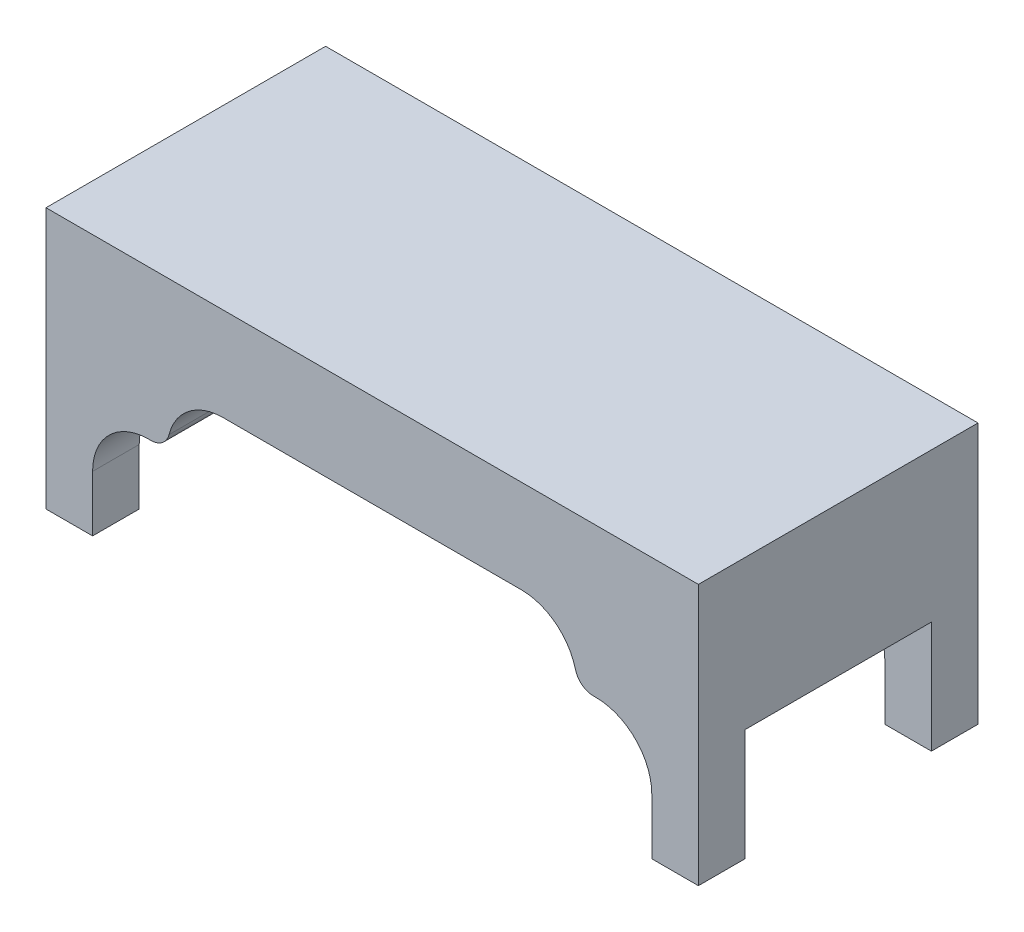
SolidWorks part; units mm, degrees
ref_plane "Vorne" through (0, 0, 0) normal (0, 0, 1) x (1, 0, 0)
ref_plane "Oben" through (0, 0, 0) normal (0, 1, 0) x (1, 0, 0)
ref_plane "Rechts" through (0, 0, 0) normal (1, 0, 0) x (0, 0, -1)
sketch "Skizze1" plane through (0, 0, 0) normal (0, 0, 1) x (1, 0, 0)
  line L0 (-8, 0) -> (8, 0) construction
  line L1 (-11.873, -3) -> (-25, -3) construction
  line L2 (-25, -3) -> (-25, -8) construction
  line L3 (-25, -8) -> (25, -8) construction
  line L4 (25, -8) -> (25, -3) construction
  line L5 (25, -3) -> (11.873, -3) construction
  line L6 (0, 0) -> (0, 3.5785) construction
  line L7 (-8, 2) -> (8, 2)
  line L8 (-11.873, -1) -> (-17.5, -1)
  line L9 (-17.5, -1) -> (-17.5, 7)
  line L10 (-17.5, 7) -> (17.5, 7)
  line L11 (17.5, 7) -> (17.5, -1)
  line L12 (17.5, -1) -> (11.873, -1)
  arc A0 (8.9682, -0.75) -> (11.873, -3) centre (11.873, 0) ccw construction
  arc A1 (8.9682, -0.75) -> (8, 0) centre (8, -1) ccw construction
  arc A2 (-8, 0) -> (-8.9682, -0.75) centre (-8, -1) ccw construction
  arc A3 (-11.873, -3) -> (-8.9682, -0.75) centre (-11.873, 0) ccw construction
  arc A4 (-11.873, -1) -> (-10.9047, -0.25) centre (-11.873, 0) ccw
  arc A5 (-8, 2) -> (-10.9047, -0.25) centre (-8, -1) ccw
  arc A6 (10.9047, -0.25) -> (8, 2) centre (8, -1) ccw
  arc A7 (10.9047, -0.25) -> (11.873, -1) centre (11.873, 0) ccw
  dimension "D1" = 1
  dimension "D2" = 3
  dimension "D3" = 16
  dimension "D4" = 5
  dimension "D5" = 3
  dimension "D6" = 50
  dimension "D8" = 5
  dimension "D9" = 35
  dimension "D7" = 2
extrude "Linear austragen1" add sketch "Skizze1" along normal blind 15
sketch "Skizze2" plane through (0, 0, 10) normal (0, 0, 1) x (1, 0, 0)
  line L0 (0, 14.2828) -> (0, 3) construction
  line L1 (-20, 8) -> (20, 8)
  line L2 (-20, 8) -> (-20, -2)
  line L3 (-20, -2) -> (20, -2)
  line L4 (20, 8) -> (20, -2)
  line L5 (0, 3) -> (6.6604, 3) construction
  line L6 (-17.5, 7) -> (-17.5, -1) construction
  line L7 (17.5, -1) -> (17.5, 7) construction
  line L8 (11.873, -1) -> (17.5, -1) construction
  line L9 (17.5, 7) -> (-17.5, 7) construction
  dimension "D1" = 10
  dimension "D2" = 40
sketch "Skizze3" plane through (0, -1, 0) normal (0, -1, 0) x (1, 0, 0)
  line L0 (17.5, 15) -> (17.5, 0) construction
  line L1 (17.5, 2.5) -> (15, 2.5)
  line L2 (17.5, 2.5) -> (17.5, 0)
  line L3 (17.5, 0) -> (15, 0)
  line L4 (15, 2.5) -> (15, 0)
  line L5 (11.873, 0) -> (17.5, 0) construction
  line L6 (11.873, 15) -> (17.5, 15) construction
  line L7 (15, 15) -> (17.5, 15)
  line L8 (15, 15) -> (15, 12.5)
  line L9 (15, 12.5) -> (17.5, 12.5)
  line L10 (17.5, 15) -> (17.5, 12.5)
  line L11 (-17.5, 0) -> (-11.873, 0) construction
  line L12 (-17.5, 0) -> (-15, 0)
  line L13 (-17.5, 0) -> (-17.5, 2.5)
  line L14 (-17.5, 2.5) -> (-15, 2.5)
  line L15 (-15, 0) -> (-15, 2.5)
  line L16 (-17.5, 15) -> (-11.873, 15) construction
  line L17 (-15, 15) -> (-17.5, 15)
  line L18 (-15, 15) -> (-15, 12.5)
  line L19 (-15, 12.5) -> (-17.5, 12.5)
  line L20 (-17.5, 15) -> (-17.5, 12.5)
  line L21 (-17.5, 15) -> (-17.5, 0) construction
  line L22 (17.5, 7.5) -> (0, 7.5) construction
  line L23 (0, 7.5) -> (0, 0) construction
  dimension "D1" = 10
  dimension "D2" = 30
extrude "Linear austragen2" add sketch "Skizze3" along normal blind 6
fillet "Verrundung1" radius 3 4 edges at (-15, -1, 1.25) (-15, -1, 13.75) (15, -1, 13.75) (15, -1, 1.25)
sketch "Skizze4" plane through (0, 0, 0) normal (0, 0, -1) x (-1, 0, 0)
  line L0 (0, 0) -> (20.0773, 0) construction
  line L1 (0, 0) -> (0, 15.4463) construction
  line L2 (-17.5, -7) -> (-17.5, 7) construction
  line L3 (17.5, 7) -> (17.5, -7) construction
  line L4 (-17.5, 7) -> (17.5, 7) construction
  line L5 (17.5, -7) -> (15, -7) construction
  line L7 (-20, -15) -> (20, -15)
  line L8 (-20, -15) -> (-20, 15)
  line L9 (-20, 15) -> (20, 15)
  line L10 (20, -15) -> (20, 15)
  dimension "D1" = 40
  dimension "D2" = 30
sketch "Skizze5" plane through (0, -7, 0) normal (0, -1, 0) x (1, 0, 0)
  line L0 (0, 7.5) -> (-30.3991, 7.5) construction
  line L1 (0, 7.5) -> (0, -8.5099) construction
  line L2 (-17.5, 15) -> (-17.5, 12.5) construction
  line L3 (17.5, 12.5) -> (17.5, 15) construction
  line L4 (-15, 15) -> (-17.5, 15) construction
  line L5 (-17.5, 0) -> (-15, 0) construction
sketch "Skizze6" plane through (0, 0, 15) normal (0, 0, 1) x (1, 0, 0)
  line L0 (0, 13.2027) -> (0, 0) construction
  line L1 (0, 0) -> (2.5312, 0) construction
  line L2 (17.5, 7) -> (-17.5, 7) construction
  line L3 (17.5, -7) -> (15, -7) construction
  line L4 (-17.5, 7) -> (-17.5, -7) construction
  line L5 (17.5, -7) -> (17.5, 7) construction
